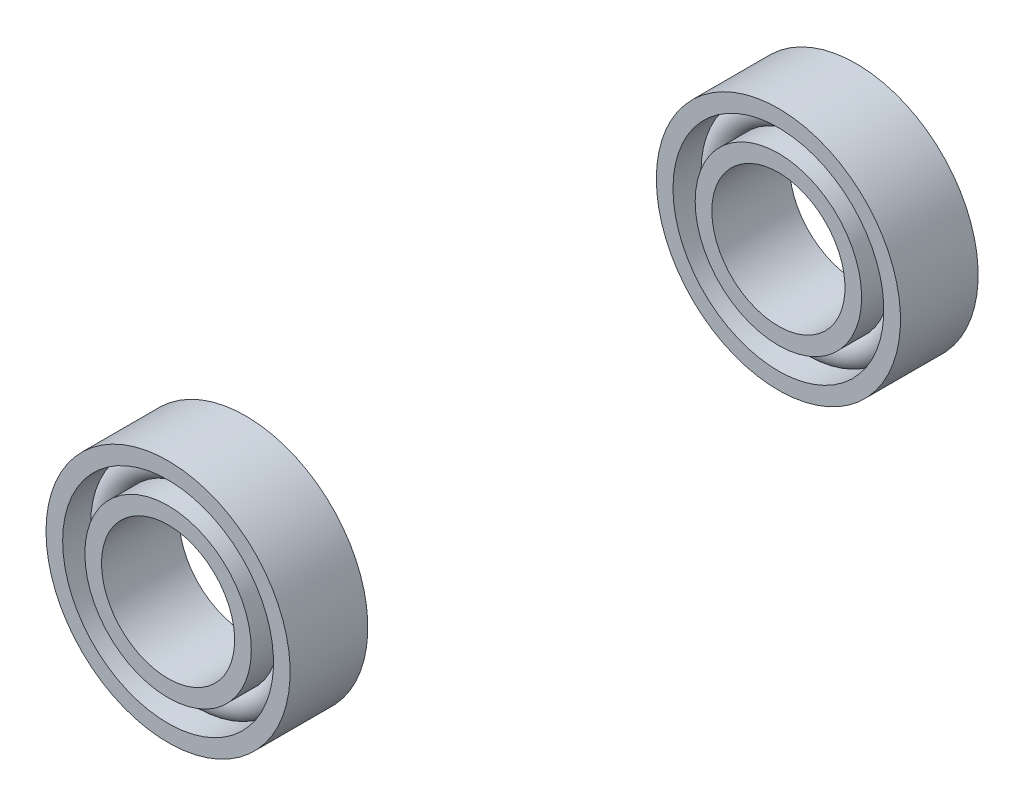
SolidWorks part; units mm, degrees
ref_plane "Alzado" through (0, 0, 0) normal (0, 0, 1) x (1, 0, 0)
ref_plane "Planta" through (0, 0, 0) normal (0, 1, 0) x (1, 0, 0)
ref_plane "Vista lateral" through (0, 0, 0) normal (1, 0, 0) x (0, 0, -1)
sketch "Sk_Pista_int_1" plane through (0, 0, 0) normal (0, 1, 0) x (1, 0, 0)
  line L0 (178.5, -84.5) -> (180, -84.5)
  line L1 (180, -84.5) -> (180, -91.5)
  line L2 (180, -91.5) -> (178.5, -91.5)
  line L3 (178.5, -91.5) -> (178.5, -84.5)
  line L4 (172.5, -79.5) -> (172.5, -96.5) construction
revolve "Pista_int_1" add sketch "Sk_Pista_int_1" angle 360 about L4
sketch "Sk_Pista_ext_1" plane through (0, 0, 0) normal (0, 1, 0) x (1, 0, 0)
  line L0 (182, -84.5) -> (183.5, -84.5)
  line L1 (183.5, -84.5) -> (183.5, -91.5)
  line L2 (183.5, -91.5) -> (182, -91.5)
  line L3 (182, -91.5) -> (182, -84.5)
  line L4 (172.5, -79.5) -> (172.5, -96.5) construction
revolve "Pista_ext_1" add sketch "Sk_Pista_ext_1" angle 360 about L4
sketch "Sk_Bolas_1" plane through (0, 0, 0) normal (0, 1, 0) x (1, 0, 0)
  line L0 (172.5, -83) -> (172.5, -93) construction
  circle A0 centre (181, -88) radius 1.4
  dimension "DIAM1" = 2.8
revolve "Bolas_1" add sketch "Sk_Bolas_1" angle 360 about L0
sketch "Sk_Pista_int_2" plane through (0, 0, 0) normal (0, 1, 0) x (1, 0, 0)
  line L0 (178.5, -139.5) -> (180, -139.5)
  line L1 (180, -139.5) -> (180, -146.5)
  line L2 (180, -146.5) -> (178.5, -146.5)
  line L3 (178.5, -146.5) -> (178.5, -139.5)
  line L4 (172.5, -134.5) -> (172.5, -151.5) construction
revolve "Pista_int_2" add sketch "Sk_Pista_int_2" angle 360 about L4
sketch "Sk_Pista_ext_2" plane through (0, 0, 0) normal (0, 1, 0) x (1, 0, 0)
  line L0 (182, -139.5) -> (183.5, -139.5)
  line L1 (183.5, -139.5) -> (183.5, -146.5)
  line L2 (183.5, -146.5) -> (182, -146.5)
  line L3 (182, -146.5) -> (182, -139.5)
  line L4 (172.5, -134.5) -> (172.5, -151.5) construction
revolve "Pista_ext_2" add sketch "Sk_Pista_ext_2" angle 360 about L4
sketch "Sk_Bolas_2" plane through (0, 0, 0) normal (0, 1, 0) x (1, 0, 0)
  line L0 (172.5, -138) -> (172.5, -148) construction
  circle A0 centre (181, -143) radius 1.4
  dimension "DIAM2" = 2.8
revolve "Bolas_2" add sketch "Sk_Bolas_2" angle 360 about L0
